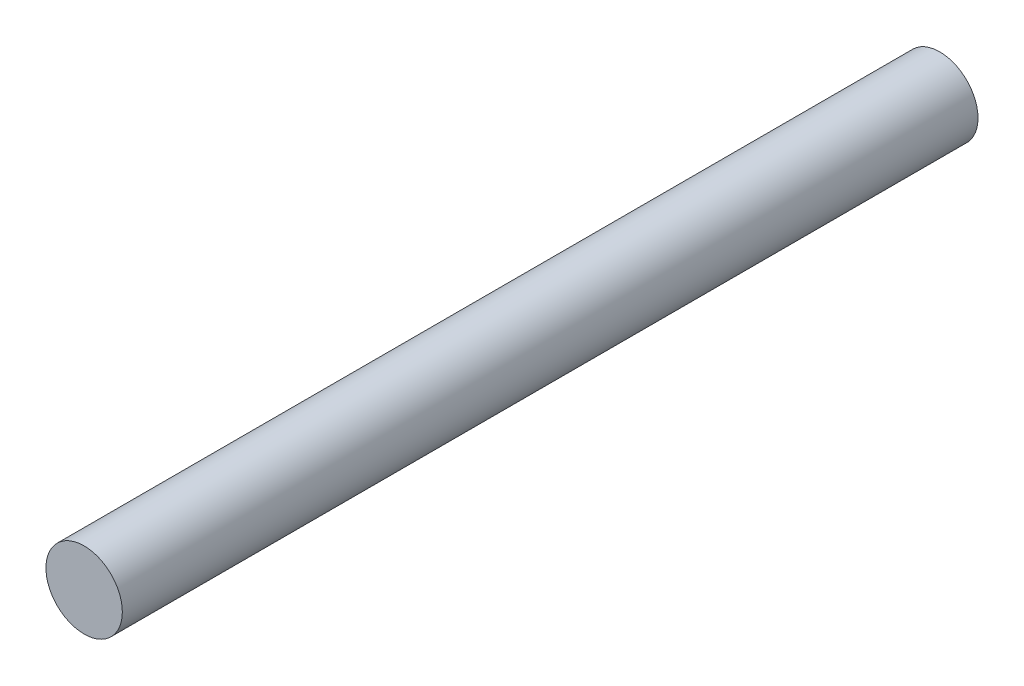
SolidWorks part; units mm, degrees
ref_plane "前视基准面" through (0, 0, 0) normal (0, 0, 1) x (1, 0, 0)
ref_plane "上视基准面" through (0, 0, 0) normal (0, 1, 0) x (1, 0, 0)
ref_plane "右视基准面" through (0, 0, 0) normal (1, 0, 0) x (0, 0, -1)
sketch "草图1" plane through (0, 0, 0) normal (0, 0, 1) x (1, 0, 0)
  circle A0 centre (0, 0) radius 5
extrude "凸台-拉伸1" add sketch "草图1" along normal blind 112
